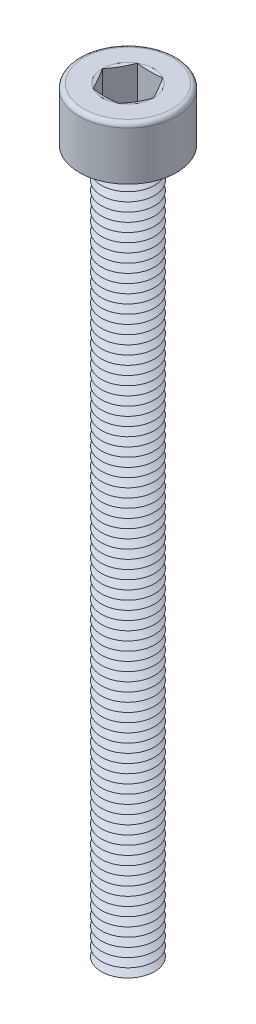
SolidWorks part; units mm, degrees
ref_plane "Front Plane" through (0, 0, 0) normal (0, 0, 1) x (1, 0, 0)
ref_plane "Top Plane" through (0, 0, 0) normal (0, 1, 0) x (1, 0, 0)
ref_plane "Right Plane" through (0, 0, 0) normal (1, 0, 0) x (0, 0, -1)
sketch "Sketch1" plane through (0, 0, 0) normal (0, 1, 0) x (1, 0, 0)
  circle A0 centre (0, 0) radius 1.5
  dimension "D1" = 3
extrude "Extrude1" add sketch "Sketch1" along normal blind 40
sketch "Sketch2" plane through (0, 40, 0) normal (0, 1, 0) x (1, 0, 0)
  circle A0 centre (0, 0) radius 2.75
  dimension "D1" = 5.5
extrude "Extrude2" add sketch "Sketch2" along normal blind 3
sketch "Sketch3" plane through (0, 43, 0) normal (0, 1, 0) x (1, 0, 0)
  line L1 (0.7217, 1.25) -> (-0.7217, 1.25)
  line L2 (-0.7217, 1.25) -> (-1.4434, 0)
  line L3 (-1.4434, 0) -> (-0.7217, -1.25)
  line L4 (-0.7217, -1.25) -> (0.7217, -1.25)
  line L5 (0.7217, -1.25) -> (1.4434, 0)
  line L6 (1.4434, 0) -> (0.7217, 1.25)
  circle A0 centre (0, 0) radius 1.25 construction
  dimension "D1" = 2.5
extrude "Extrude3" cut sketch "Sketch3" against normal blind 2.5
fillet "Fillet1" radius 0.25 1 edges at (0, 43, 2.75)
sketch "Sketch4" plane through (0, 0, 0) normal (1, 0, 0) x (0, 0, -1)
  line L0 (-1.25, 40.5) -> (0, 40.5)
  line L1 (0, 40.5) -> (0, 39.7783)
  line L2 (0, 39.7783) -> (-1.25, 40.5)
  dimension "D1" = 30
revolve "Cut-Revolve1" cut sketch "Sketch4" angle 360 about L1
sketch "Sketch5" plane through (0, 0, 0) normal (0, 0, 1) x (1, 0, 0)
  line L0 (-1.5, 0.25) -> (-1.5, -0.25)
  line L1 (-1.5, 40) -> (-1.5, 0) construction
  line L2 (-1.5, -0.25) -> (-1.067, 0)
  line L3 (-1.5, 0) -> (1.5, 0) construction
  line L4 (-1.067, 0) -> (-1.5, 0.25)
  dimension "D1" = 0.5
revolve "Cut-Revolve2" cut sketch "Sketch5" angle 360 about axis through (0, 40, 0) along (0, -1, 0)
pattern_linear "LPattern1" count 80 spacing 0.5 along (0, 1, 0) of "Cut-Revolve2"
sketch "Sketch6" plane through (0, 43, 0) normal (0, 1, 0) x (1, 0, 0)
  circle A0 centre (0, 0) radius 1.4434
extrude "Extrude4" cut sketch "Sketch6" against normal through all draft 75
